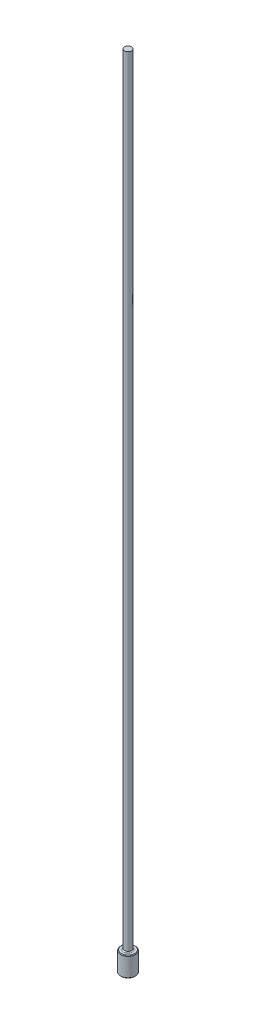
SolidWorks part; units mm, degrees
ref_plane "Front Plane" through (0, 0, 0) normal (0, 0, 1) x (1, 0, 0)
ref_plane "Top Plane" through (0, 0, 0) normal (0, 1, 0) x (1, 0, 0)
ref_plane "Right Plane" through (0, 0, 0) normal (1, 0, 0) x (0, 0, -1)
other "Configuration Table"
sketch "Sketch1" plane through (0, 0, 0) normal (0, 0, 1) x (1, 0, 0)
  line L0 (0, 259.9588) -> (0, -15.1925) construction
  line L1 (0, 0) -> (-0.5842, 0)
  line L2 (-0.5842, 0) -> (-0.5842, 1.5748)
  line L3 (-0.5842, 1.5748) -> (-0.2794, 1.5748)
  line L4 (-0.2794, 1.5748) -> (-0.2794, 63.5)
  line L5 (-0.2794, 63.5) -> (0, 63.5)
  line L6 (0, 63.5) -> (0, 0)
  dimension "L" = 63.5
  dimension "H" = 1.1684
  dimension "T" = 1.5748
  dimension "D" = 0.5588
revolve "Revolve1" add sketch "Sketch1" angle 360 about L0
chamfer "Chamfer1" distance 0.0508 angle 45 2 edges at (0, 1.5748, 0.5842) (0, 0, 0.5842)
fillet "Fillet1" radius 0.0762 1 edges at (0, 1.5748, 0.2794)
